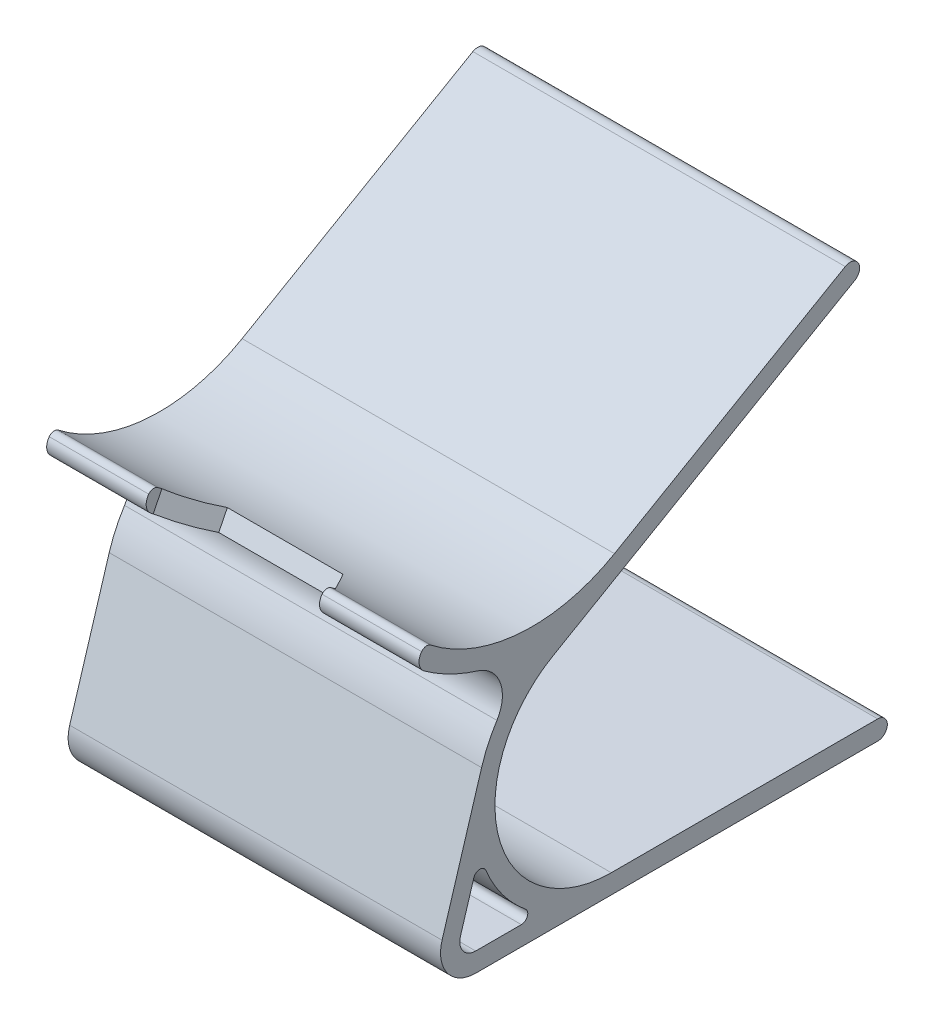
SolidWorks part; units mm, degrees
ref_plane "Front Plane" through (0, 0, 0) normal (0, 0, 1) x (1, 0, 0)
ref_plane "Top Plane" through (0, 0, 0) normal (0, 1, 0) x (1, 0, 0)
ref_plane "Right Plane" through (0, 0, 0) normal (1, 0, 0) x (0, 0, -1)
sketch "Sketch1" plane through (0, 0, 0) normal (1, 0, 0) x (0, 0, -1)
  line L0 (0, 0) -> (43, 0)
  line L1 (43, 0) -> (43, 3)
  line L2 (43, 3) -> (0, 3)
  line L4 (37.7405, 67.291) -> (39.2405, 64.6929)
  line L5 (39.2405, 64.6929) -> (-9.0587, 36.8074)
  line L6 (37.7405, 67.291) -> (0.5014, 45.791)
  line L9 (-28.1298, 47.777) -> (-28.9185, 48.3918)
  line L10 (-28.9185, 48.3918) -> (-30.7629, 46.0257)
  line L11 (-30.7629, 46.0257) -> (-29.9742, 45.4109)
  line L12 (-10.5587, 39.4055) -> (-9.0587, 36.8074) construction
  line L13 (-26.3565, 7.0739) -> (-20.2, 27.2739)
  line L14 (-21.1173, 0) -> (0, 0)
  line L15 (-21.4136, 13.0015) -> (-23.4868, 6.1993)
  line L16 (-21.1173, 3) -> (-14.0062, 3)
  line L17 (-20.4932, 16.0214) -> (-17.3303, 26.3992) construction
  line L18 (-20.4932, 16.0214) -> (-21.4136, 13.0015) construction
  line L19 (-14.0062, 3) -> (-10.8491, 3) construction
  arc A0 (-20.2, 27.2739) -> (-17.8142, 32.4573) centre (0, 21.1173) cw
  arc A1 (0, 3) -> (-9.0587, 36.8074) centre (0, 21.1173) cw
  arc A2 (0.5014, 45.791) -> (-28.1298, 47.777) centre (-12.3402, 68.0333) cw
  arc A3 (-29.9742, 45.4109) -> (-20.8161, 40.631) centre (-12.3402, 68.0333) ccw
  arc A4 (-21.1173, 0) -> (-26.3565, 7.0739) centre (-21.1173, 5.4771) cw
  arc A5 (0, 0) -> (-10.8491, 3) centre (0, 21.1173) cw construction
  arc A6 (-20.8161, 40.631) -> (-17.8142, 32.4573) centre (-22.4346, 35.3985) cw
  arc A7 (-20.8161, 40.631) -> (-10.5587, 39.4055) centre (-12.3402, 68.0333) ccw construction
  arc A8 (-17.8142, 32.4573) -> (-10.5587, 39.4055) centre (0, 21.1173) cw construction
  arc A10 (-20.4932, 16.0214) -> (-20.2, 27.2739) centre (0, 21.1173) cw construction
  arc A11 (-19.5322, 13.0901) -> (-13.3729, 4.7739) centre (0, 21.1173) ccw
  arc A12 (-21.4136, 13.0015) -> (-19.5322, 13.0901) centre (-20.4571, 12.71) cw
  arc A13 (-13.3729, 4.7739) -> (-14.0062, 3) centre (-14.0062, 4) cw
  arc A15 (-20.4932, 16.0214) -> (-19.5322, 13.0901) centre (0, 21.1173) ccw construction
  arc A16 (-13.3729, 4.7739) -> (-10.8491, 3) centre (0, 21.1173) ccw construction
  arc A17 (-21.1173, 3) -> (-23.4868, 6.1993) centre (-21.1173, 5.4771) cw
  point P7 (-21.1173, 21.1173)
  dimension "D4" = 28.7
  dimension "D8" = 1
  dimension "D1" = 68.7
  dimension "D2" = 43
  dimension "D3" = 3
  dimension "D5" = 1
  dimension "D6" = 35
  dimension "D7" = 30
extrude "Boss-Extrude1" add sketch "Sketch1" along normal blind 58
fillet "Fillet1" radius 2 1 edges at (29, 46.0257, 30.7629)
fillet "Fillet2" radius 1 1 edges at (29, 48.3918, 28.9185)
fillet "Fillet3" radius 1.5 4 edges at (29, 3, -43) (29, 0, -43) (29, 64.6929, -39.2405) (29, 67.291, -37.7405)
ref_plane "Plane1" through (0, 24.2389, -12.0787) normal (0, -0.895, 0.446) x (-1, 0, 0)
sketch "Sketch2" plane through (0, 24.2389, -12.0787) normal (0, -0.895, 0.446) x (-1, 0, 0)
  line L0 (-42.5, -47.7006) -> (-15.5, -47.7006)
  line L1 (-15.5, -47.7006) -> (-15.5, -45.7006)
  line L2 (-15.5, -45.7006) -> (-20, -39.2006)
  line L3 (-20, -39.2006) -> (-38, -39.2006)
  line L4 (-38, -39.2006) -> (-42.5, -45.7006)
  line L5 (-42.5, -45.7006) -> (-42.5, -47.7006)
  line L6 (-58, -47.7006) -> (0, -47.7006) construction
  line L8 (-58, -36.7528) -> (0, -36.7528) construction
  point P8 (-29, -36.7528)
  point P9 (-29, -39.2006)
  point P10 (-29, -47.7006)
  dimension "D1" = 8.5
  dimension "D2" = 2
  dimension "D3" = 18
  dimension "D4" = 27
extrude "Cut-Extrude1" cut sketch "Sketch2" against normal through all both and the other way through all
